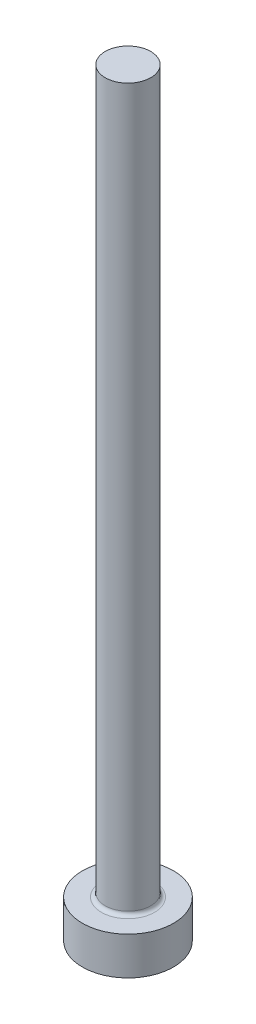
SolidWorks part; units mm, degrees
ref_plane "Plano frontal" through (0, 0, 0) normal (0, 0, 1) x (1, 0, 0)
ref_plane "Plano superior" through (0, 0, 0) normal (0, 1, 0) x (1, 0, 0)
ref_plane "Plano direito" through (0, 0, 0) normal (1, 0, 0) x (0, 0, -1)
sketch "Esboço1" plane through (0, 0, 0) normal (0, 0, 1) x (1, 0, 0)
  line L0 (0, 0) -> (6, 0)
  line L1 (6, 0) -> (6, 5)
  line L2 (6, 5) -> (3.5, 5)
  line L3 (3, 5.5) -> (3, 100)
  line L4 (3, 100) -> (0, 100)
  line L5 (0, 100) -> (0, 0) construction
  line L6 (0, 0) -> (0, 100)
  arc A0 (3.5, 5) -> (3, 5.5) centre (3.5, 5.5) cw
  dimension "D3" = 0.5
  dimension "D1" = 12
  dimension "D2" = 6
  dimension "D4" = 5
  dimension "D5" = 100
revolve "Revolução1" add sketch "Esboço1" angle 360 about L5
sketch "Esboço2"
  dimension "D1" = 3.225
  dimension "D2" = 1.05
  dimension "D3" = 0.675
  dimension "D4" = 0.45
wrap "Envolver1" sketch "Esboço2" wrap type deboss source sketch "Esboço2" thickness 0.1 parameters "D1"=0.1
